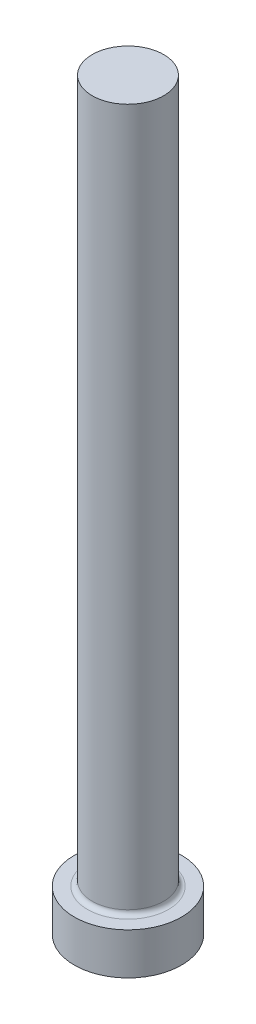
SolidWorks part; units mm, degrees
ref_plane "Plano frontal" through (0, 0, 0) normal (0, 0, 1) x (1, 0, 0)
ref_plane "Plano superior" through (0, 0, 0) normal (0, 1, 0) x (1, 0, 0)
ref_plane "Plano direito" through (0, 0, 0) normal (1, 0, 0) x (0, 0, -1)
sketch "Esboço1" plane through (0, 0, 0) normal (0, 0, 1) x (1, 0, 0)
  line L0 (0, 0) -> (9, 0)
  line L1 (9, 0) -> (9, 7)
  line L2 (9, 7) -> (6.8, 7)
  line L3 (6, 7.8) -> (6, 125)
  line L4 (6, 125) -> (0, 125)
  line L5 (0, 125) -> (0, 0) construction
  line L6 (0, 0) -> (0, 125)
  arc A0 (6.8, 7) -> (6, 7.8) centre (6.8, 7.8) cw
  dimension "D3" = 0.8
  dimension "D1" = 18
  dimension "D2" = 12
  dimension "D4" = 7
  dimension "D5" = 125
revolve "Revolução1" add sketch "Esboço1" angle 360 about L5
sketch "Esboço2"
  dimension "D1" = 1.0125
  dimension "D2" = 1.575
  dimension "D3" = 0.675
  dimension "D4" = 4.8375
wrap "Envolver1" sketch "Esboço2" wrap type deboss source sketch "Esboço2" thickness 0.1 parameters "D1"=0.1
